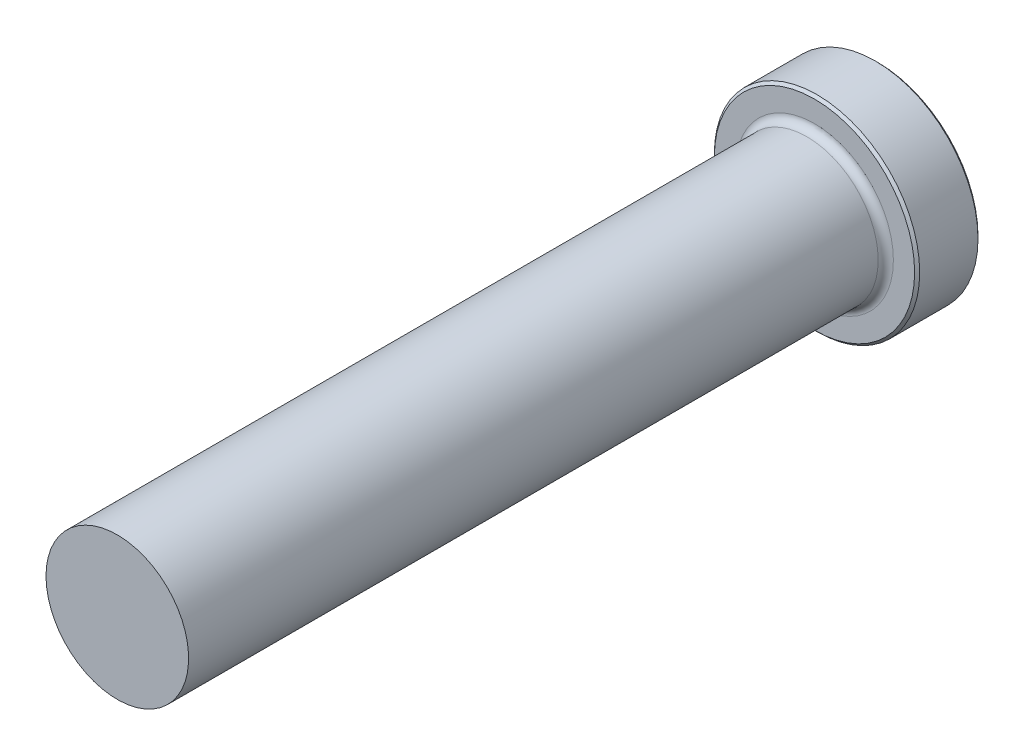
SolidWorks part; units mm, degrees
ref_plane "Front Plane" through (0, 0, 0) normal (0, 0, 1) x (1, 0, 0)
ref_plane "Top Plane" through (0, 0, 0) normal (0, 1, 0) x (1, 0, 0)
ref_plane "Right Plane" through (0, 0, 0) normal (1, 0, 0) x (0, 0, -1)
sketch "Sketch1" plane through (0, 0, 0) normal (1, 0, 0) x (0, 0, -1)
  line L0 (0, 0) -> (-156.8087, 0) construction
  line L1 (0, 0) -> (0, 10.287)
  line L2 (0, 10.287) -> (-6.35, 10.287)
  line L3 (-6.35, 10.287) -> (-6.35, 7.1437)
  line L4 (-6.35, 7.1437) -> (-76.2, 7.1437)
  line L5 (-76.2, 7.1437) -> (-76.2, 0)
  line L6 (-76.2, 0) -> (0, 0)
  dimension "D1" = 20.574
  dimension "D2" = 14.2875
  dimension "D3" = 6.35
  dimension "D4" = 76.2
revolve "Revolve1" add sketch "Sketch1" angle 360 about L0
fillet "Fillet1" radius 0.762 1 edges at (-7.1437, 0, 6.35)
chamfer "Chamfer1" distance 0.254 angle 45 2 edges at (-10.287, 0, 0) (-10.287, 0, 6.35)
